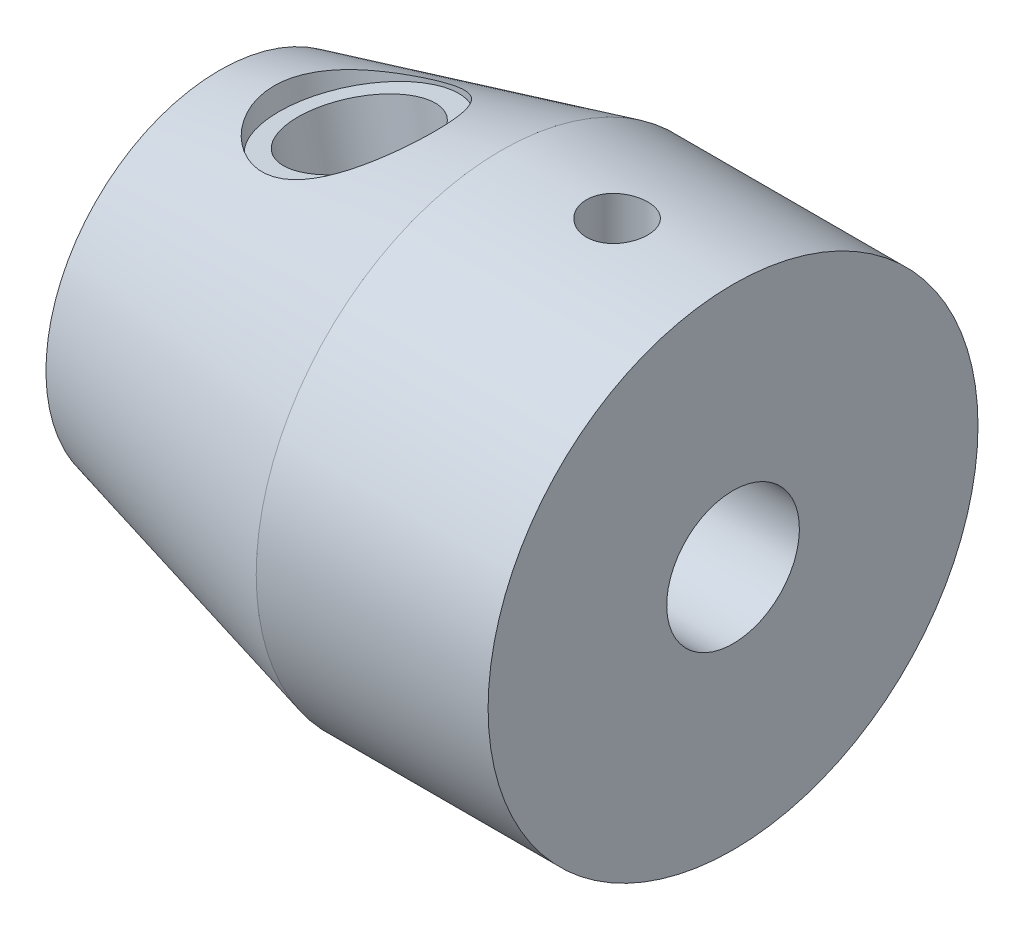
SolidWorks part; units mm, degrees
ref_plane "Front Plane" through (0, 0, 0) normal (0, 0, 1) x (1, 0, 0)
ref_plane "Top Plane" through (0, 0, 0) normal (0, 1, 0) x (1, 0, 0)
ref_plane "Right Plane" through (0, 0, 0) normal (1, 0, 0) x (0, 0, -1)
sketch "Sketch1" plane through (0, 0, 0) normal (0, 0, 1) x (1, 0, 0)
  line L0 (0, 0) -> (0, 8.5)
  line L1 (0, 8.5) -> (13.8, 12)
  line L2 (13.8, 12) -> (25.16, 12)
  line L3 (25.16, 12) -> (25.16, 0)
  line L4 (25.16, 0) -> (0, 0)
  dimension "D1" = 8.5
  dimension "D2" = 12
  dimension "D3" = 11.36
  dimension "D4" = 13.8
revolve "Revolve1" add sketch "Sketch1" angle 360 about L4
sketch "Sketch3" plane through (25.16, 0, 0) normal (1, 0, 0) x (0, 0, -1)
  circle A0 centre (0, 0) radius 3.25
  dimension "D1" = 6.5
extrude "Cut-Extrude2" cut sketch "Sketch3" against normal blind 10
ref_plane "Plane1" through (-2.0255, 7.9863, 0) normal (-0.2458, 0.9693, 0) x (0.9693, 0.2458, 0)
sketch "Sketch4" plane through (-2.0255, 7.9863, 0) normal (-0.2458, 0.9693, 0) x (0.9693, 0.2458, 0)
  line L0 (13.3765, 0) -> (0, 0) construction
  circle A0 centre (8.9038, 0) radius 3.1
  dimension "D1" = 6.2
  dimension "D2" = 8.9038
extrude "Cut-Extrude3" cut sketch "Sketch4" against normal blind 11
sketch "Sketch5" plane through (-2.0255, 7.9863, 0) normal (-0.2458, 0.9693, 0) x (0.9693, 0.2458, 0)
  circle A0 centre (8.9038, 0) radius 4.055
  dimension "D1" = 8.11
extrude "Cut-Extrude5" cut sketch "Sketch5" against normal blind 1
ref_plane "Plane2" through (0, 12, 0) normal (0, 1, 0) x (1, 0, 0)
sketch "Sketch6" plane through (0, 12, 0) normal (0, 1, 0) x (1, 0, 0)
  line L2 (13.8, 0) -> (25.16, 0) construction
  circle A0 centre (19.48, 0) radius 1.5
  point P6 (19.48, 0)
  dimension "D1" = 3
extrude "Cut-Extrude6" cut sketch "Sketch6" against normal through all
